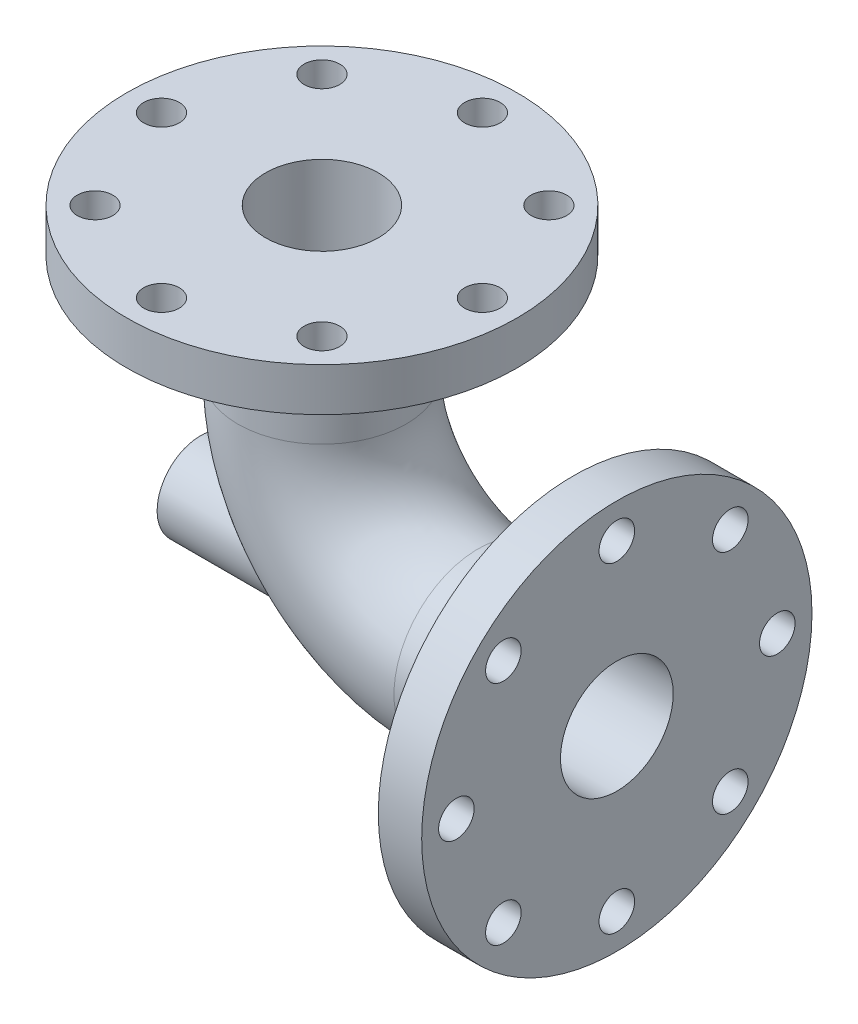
SolidWorks part; units mm, degrees
ref_plane "Front Plane" through (0, 0, 0) normal (0, 0, 1) x (1, 0, 0)
ref_plane "Top Plane" through (0, 0, 0) normal (0, 1, 0) x (1, 0, 0)
ref_plane "Right Plane" through (0, 0, 0) normal (1, 0, 0) x (0, 0, -1)
sketch "Sketch1" plane through (0, 0, 0) normal (0, 0, 1) x (1, 0, 0)
  line L0 (-90, 0) -> (-90, 85)
  line L1 (0, -90) -> (55, -90)
  arc A0 (-90, 0) -> (0, -90) centre (0, 0) ccw
  dimension "D1" = 90
  dimension "D2" = 175
  dimension "D3" = 145
ref_plane "Plane1" through (55, -90, 0) normal (1, 0, 0) x (0, 0, -1)
sketch "Sketch2" plane through (55, -90, 0) normal (1, 0, 0) x (0, 0, -1)
  circle A0 centre (0, 0) radius 48.5
  dimension "D1" = 97
sweep "Sweep-Thin1" add profiles "Sketch2" path "Sketch1" parameters "D1"=16
sketch "Sketch3" plane through (0, 85, 0) normal (0, 1, 0) x (1, 0, 0)
  circle A0 centre (-90, 0) radius 112.5
  circle A1 centre (-90, 0) radius 48.5
  dimension "D1" = 225
extrude "Boss-Extrude1" add sketch "Sketch3" against normal blind 25
other "Hole1"
sketch "Sketch4" plane through (0, 85, 0) normal (0, 1, 0) x (-1, 0, 0)
  circle A0 centre (-2.5, 0) radius 10.25
  circle A3 centre (90, 0) radius 92.5 construction
  dimension "D1" = 20.5
  dimension "D2" = 185
pattern_circular "CirPattern1" count 8 over 360 about axis through (-90, 0, 0) along (0, 1, 0) of "Hole1"
sketch "Sketch5" plane through (55, 0, 0) normal (1, 0, 0) x (0, 0, -1)
  circle A0 centre (0, -90) radius 112.5
  circle A1 centre (0, -90) radius 32.5 construction
  circle A2 centre (0, -90) radius 32.5
  dimension "D1" = 225
extrude "Boss-Extrude2" add sketch "Sketch5" along normal blind 25
other "Hole2"
sketch "Sketch6" plane through (80, 0, 0) normal (1, 0, 0) x (0, 0, -1)
  circle A0 centre (92.5, -90) radius 10.25
  circle A1 centre (0, -90) radius 92.5 construction
  dimension "D1" = 20.5
  dimension "D2" = 185
pattern_circular "CirPattern2" count 8 over 360 about axis through (0, -90, 0) along (1, 0, 0) of "Hole2"
ref_plane "Plane2" through (-160, 0, 0) normal (1, 0, 0) x (0, 0, -1)
sketch "Sketch7" plane through (-160, 0, 0) normal (1, 0, 0) x (0, 0, -1)
  circle A0 centre (0, -90) radius 25
  circle A1 centre (0, -90) radius 112.5 construction
  dimension "D1" = 50
extrude "Boss-Extrude3" add sketch "Sketch7" along normal up to next
hole_wizard "CBORE for M16 Hex Head Bolt1" positions "Sketch10" profile "Sketch9" counterbore size "M16" standard "Ansi Metric"
sketch "Sketch10" plane through (-160, 0, 0) normal (-1, 0, 0) x (0, 0, 1)
  circle A0 centre (0, -90) radius 25 construction
  point P0 (0, -90)
sketch "Sketch9" plane through (-160, -90, 0) normal (0, 1, 0) x (0, 0, 1)
  line L0 (0, 0) -> (0, 76.8961)
  line L1 (0, 76.8961) -> (10, 76.8961)
  line L3 (10, 76.8961) -> (10, 28)
  line L4 (10, 28) -> (12, 28)
  line L5 (12, 28) -> (12, 0)
  line L7 (12, 0) -> (0, 0)
  line L11 (0, -6.35) -> (0, 107.95) construction
  dimension "Thru Hole Dia." = 20
  dimension "Thru Hole Depth" = 76.8961
  dimension "C'Bore Dia." = 24
  dimension "C'Bore Depth" = 28
